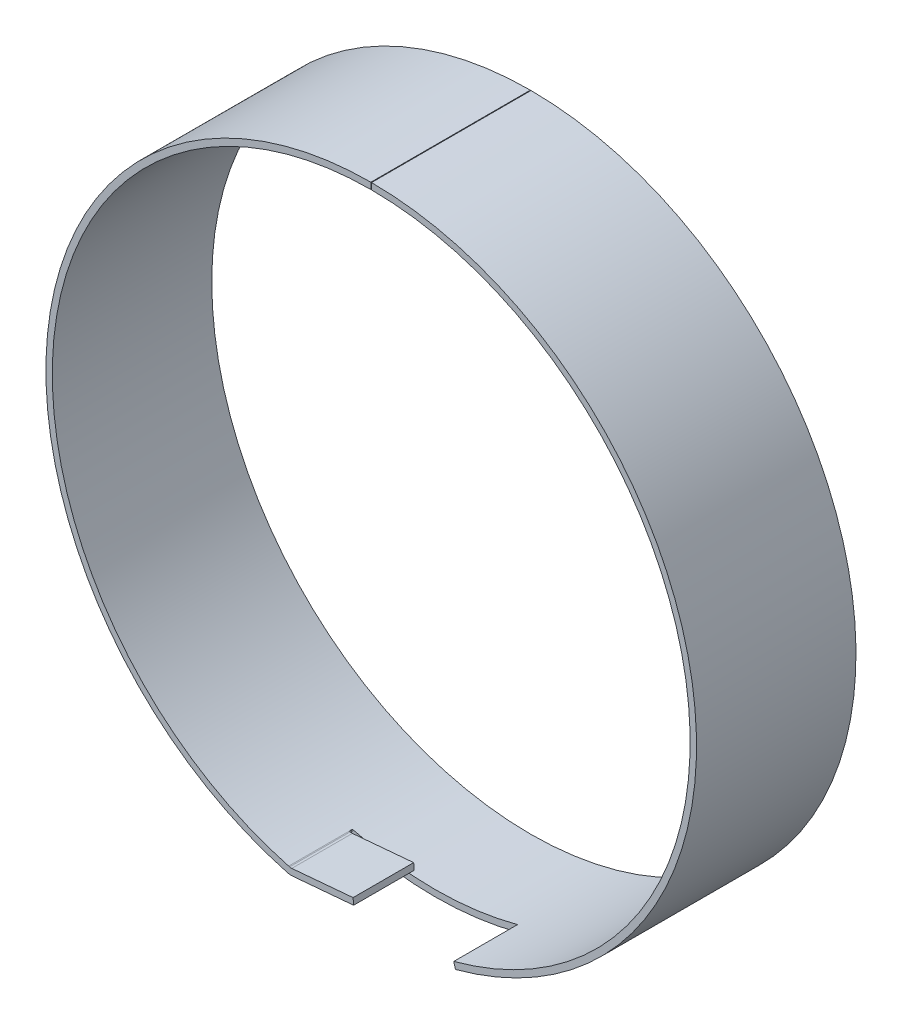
SolidWorks part; units mm, degrees
ref_plane "Ebene vorne" through (0, 0, 0) normal (0, 0, 1) x (1, 0, 0)
ref_plane "Ebene oben" through (0, 0, 0) normal (0, 1, 0) x (1, 0, 0)
ref_plane "Ebene rechts" through (0, 0, 0) normal (1, 0, 0) x (0, 0, -1)
sketch "Skizze1" plane through (0, 0, 0) normal (0, 0, 1) x (1, 0, 0)
  circle A0 centre (0, 0) radius 100
  dimension "D1" = 200
extrude "Linear-Austragen-Dünn1" add sketch "Skizze1" along normal blind 50 thin
sketch "Skizze2" plane through (0, 0, 50) normal (0, 0, 1) x (1, 0, 0)
  line L1 (-0.1, 0) -> (0.1, 0)
  line L2 (-0.1, 0) -> (-0.1, 102)
  line L3 (-0.1, 102) -> (0.1, 102)
  line L4 (0.1, 0) -> (0.1, 102)
  circle A0 centre (0, 0) radius 102 construction
  dimension "D1" = 0.2
extrude "Schnitt-Linear austragen1" cut sketch "Skizze2" against normal through all
sketch "Skizze3" plane through (0, 0, 50) normal (0, 0, 1) x (1, 0, 0)
  line L0 (0, 0) -> (-26.3995, -98.5244)
  line L1 (0, 0) -> (26.3995, -98.5244)
  line L2 (0, 0) -> (0, -126.0172) construction
  arc A0 (-0.1, 102) -> (0.1, 102) centre (0, 0) ccw construction
  arc A1 (-26.3995, -98.5244) -> (26.3995, -98.5244) centre (0, 0) ccw
  dimension "D1" = 30
extrude "Schnitt-Linear austragen2" cut sketch "Skizze3" against normal blind 20
sketch "Skizze4" plane through (0, 0, 50) normal (0, 0, 1) x (1, 0, 0)
  line L0 (-25.8819, -96.5926) -> (-26.3995, -98.5244)
  line L1 (-25.8819, -96.5926) -> (-24.916, -96.8514)
  line L2 (-26.3995, -98.5244) -> (-25.4336, -98.7833)
  line L3 (-24.916, -96.8514) -> (-25.4336, -98.7833)
  line L4 (-25.8819, -96.5926) -> (-26.3995, -98.5244) construction
  arc A0 (-0.1, 102) -> (-26.3995, -98.5244) centre (0, 0) ccw construction
  dimension "D1" = 1
extrude "Linear austragen1" add sketch "Skizze4" against normal blind 19
sketch "Skizze9" plane through (0, 0, 50) normal (0, 0, 1) x (1, 0, 0)
  line L0 (-25.4336, -98.7833) -> (-25.6079, -96.7909)
  line L1 (-25.4336, -98.7833) -> (-5.5097, -97.0401)
  line L2 (-25.6079, -96.7909) -> (-5.684, -95.0477)
  line L3 (-5.5097, -97.0401) -> (-5.684, -95.0477)
  line L4 (-25.4336, -98.7833) -> (-24.916, -96.8514) construction
  line L5 (-26.3995, -98.5244) -> (-25.4336, -98.7833) construction
  dimension "D1" = 20
  dimension "D2" = 20
extrude "Linear austragen2" add sketch "Skizze9" against normal up to vertex
fillet "Verrundung1" radius 4 1 edges at (-25.4336, -98.7833, 40.5)
fillet "Verrundung2" radius 2 1 edges at (-25.2566, -96.7601, 40.5)
surface "Oberfläche-Offset1" parameters "D1"=0.7
